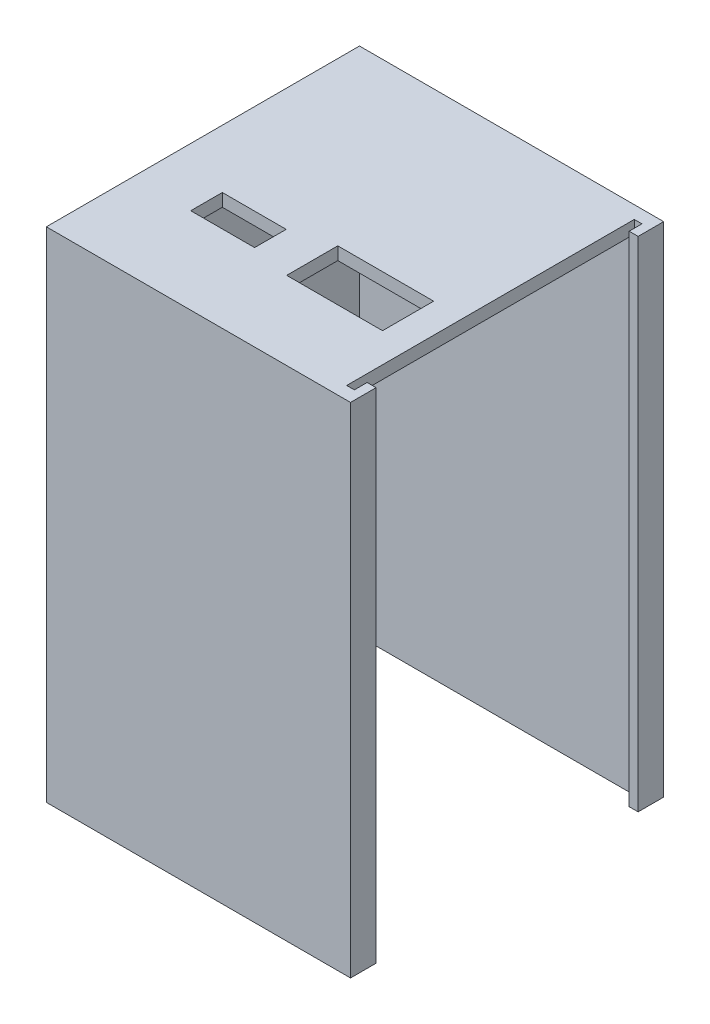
SolidWorks part; units mm, degrees
ref_plane "Front Plane" through (0, 0, 0) normal (0, 0, 1) x (1, 0, 0)
ref_plane "Top Plane" through (0, 0, 0) normal (0, 1, 0) x (1, 0, 0)
ref_plane "Right Plane" through (0, 0, 0) normal (1, 0, 0) x (0, 0, -1)
sketch "Sketch1" plane through (0, 0, 0) normal (0, 1, 0) x (1, 0, 0)
  line L1 (-21.5, 22.5) -> (21.5, 22.5)
  line L2 (-21.5, 22.5) -> (-21.5, -22.5)
  line L3 (-21.5, -22.5) -> (21.5, -22.5)
  line L4 (21.5, 22.5) -> (21.5, -22.5)
  line L5 (-21.5, 22.5) -> (21.5, -22.5) construction
  line L6 (-21.5, -22.5) -> (21.5, 22.5) construction
  point P0 (0, 0)
  dimension "D1" = 45
  dimension "D2" = 43
extrude "Boss-Extrude1" add sketch "Sketch1" against normal blind 2
sketch "Sketch2" plane through (0, 0, 0) normal (0, 1, 0) x (1, 0, 0)
  line L0 (-21.5, 22.5) -> (-21.5, -22.5) construction
  line L1 (21.5, 22.5) -> (22.7, 22.5)
  line L2 (21.5, 22.5) -> (21.5, -22.5)
  line L3 (21.5, -22.5) -> (22.7, -22.5)
  line L4 (22.7, 22.5) -> (22.7, -22.5)
  dimension "D1" = 1.2
sketch "Sketch3" plane through (0, -2, 0) normal (0, -1, 0) x (-1, 0, 0)
  line L0 (-9.3835, -8.2765) -> (9.3835, -8.2765) construction
  line L1 (-16.8835, -4.2765) -> (-1.8835, -4.2765)
  line L2 (-16.8835, -4.2765) -> (-16.8835, -12.2765)
  line L3 (-16.8835, -12.2765) -> (-1.8835, -12.2765)
  line L4 (-1.8835, -4.2765) -> (-1.8835, -12.2765)
  line L5 (-16.8835, -4.2765) -> (-1.8835, -12.2765) construction
  line L6 (-16.8835, -12.2765) -> (-1.8835, -4.2765) construction
  line L7 (4.3873, -6.081) -> (14.3796, -6.081)
  line L8 (4.3873, -6.081) -> (4.3873, -10.472)
  line L10 (14.3796, -6.081) -> (14.3796, -10.081)
  line L11 (4.3873, -6.081) -> (14.3796, -10.081) construction
  line L12 (4.3873, -10.472) -> (14.3796, -6.081) construction
  line L13 (21.5, 22.5) -> (21.5, -22.5) construction
  line L14 (0, -8.2765) -> (0, 0) construction
  line L15 (4.3873, -10.472) -> (4.3873, -11.0244)
  line L16 (4.3873, -11.0244) -> (14.3796, -11.0244)
  line L17 (14.3796, -11.0244) -> (14.3796, -10.081)
  point P0 (-9.3835, -8.2765)
  point P5 (9.6163, -8.1742)
  dimension "D1" = 15
  dimension "D2" = 8
  dimension "D3" = 19
  dimension "D4" = 90
  dimension "D5" = 10
  dimension "D6" = 4
  dimension "D9" = 11.8837
extrude "Cut-Extrude1" cut sketch "Sketch3" against normal blind 2
sketch "Sketch4" plane through (0, 0, 0) normal (0, 1, 0) x (1, 0, 0)
  line L0 (-21.5, 22.5) -> (-21.5, -22.5) construction
  line L1 (-23.5, -22.5) -> (-21.5, -22.5)
  line L2 (-23.5, -22.5) -> (-23.5, 22.5)
  line L3 (-23.5, 22.5) -> (-21.5, 22.5)
  line L4 (-21.5, -22.5) -> (-21.5, 22.5)
  line L5 (-23.5, -22.5) -> (-21.5, 22.5) construction
  line L6 (-23.5, 22.5) -> (-21.5, -22.5) construction
  line L7 (21.5, 22.5) -> (21.5, -22.5) construction
  point P0 (-22.5, 0)
  dimension "D1" = 2
extrude "Boss-Extrude2" add sketch "Sketch4" against normal blind 78
sketch "Sketch5" plane through (0, 0, 0) normal (0, 1, 0) x (1, 0, 0)
  line L0 (-21.5, -22.5) -> (21.5, -22.5) construction
  line L1 (-23.5, 24.5) -> (22.7, 24.5)
  line L2 (-23.5, 24.5) -> (-23.5, 22.5)
  line L3 (-23.5, 22.5) -> (22.7, 22.5)
  line L4 (22.7, 24.5) -> (22.7, 22.5)
  line L5 (-23.5, 24.5) -> (22.7, 22.5) construction
  line L6 (-23.5, 22.5) -> (22.7, 24.5) construction
  point P0 (-0.4, 23.5)
  dimension "D1" = 2
extrude "Boss-Extrude3" add sketch "Sketch5" against normal blind 78
sketch "Sketch6" plane through (0, 0, 0) normal (0, 1, 0) x (1, 0, 0)
  line L0 (22.7, 24.5) -> (-23.5, 24.5) construction
  line L1 (22.7, -22.5) -> (-23.5, -22.5)
  line L2 (22.7, -22.5) -> (22.7, -24.5)
  line L3 (22.7, -24.5) -> (-23.5, -24.5)
  line L4 (-23.5, -22.5) -> (-23.5, -24.5)
  dimension "D1" = 2
extrude "Boss-Extrude4" add sketch "Sketch6" against normal blind 78
sketch "Sketch7" plane through (22.7, 0, 0) normal (1, 0, 0) x (0, 0, -1)
  line L1 (24.5, 0) -> (20.5, 0)
  line L2 (24.5, 0) -> (24.5, -77.9885)
  line L3 (24.5, -77.9885) -> (20.5, -77.9885)
  line L4 (20.5, 0) -> (20.5, -77.9885)
  dimension "D1" = 4
extrude "Boss-Extrude5" add sketch "Sketch7" along normal blind 1.4
sketch "Sketch8" plane through (22.7, 0, 0) normal (1, 0, 0) x (0, 0, -1)
  line L1 (-24.5, 0) -> (-20.5, 0)
  line L2 (-24.5, 0) -> (-24.5, -78)
  line L3 (-24.5, -78) -> (-20.5, -78)
  line L4 (-20.5, 0) -> (-20.5, -78)
  dimension "D1" = 4
extrude "Boss-Extrude6" add sketch "Sketch8" along normal blind 1.4
